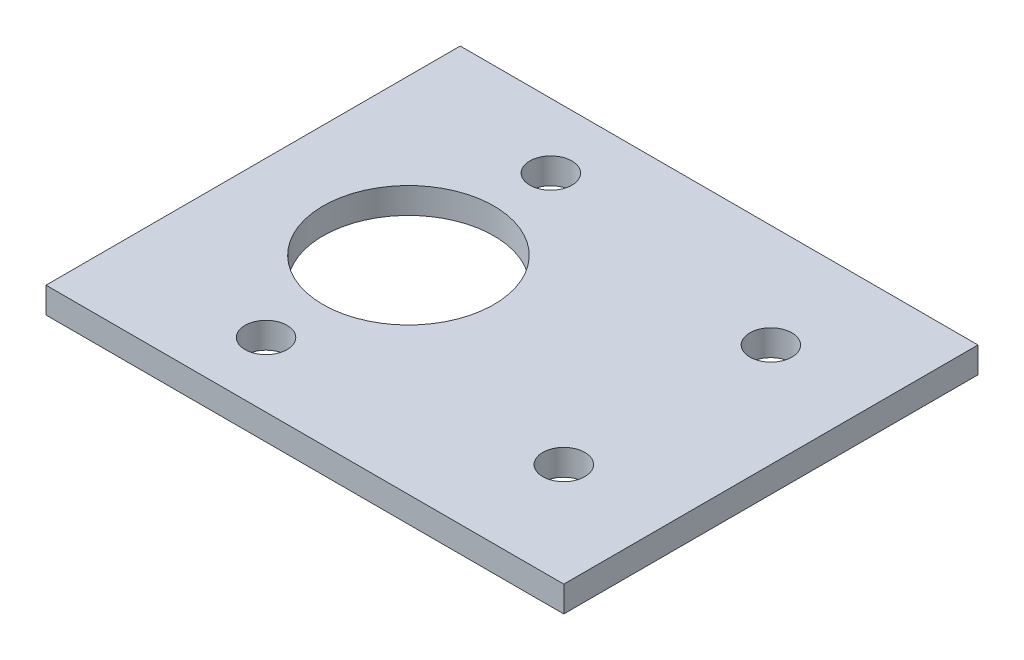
SolidWorks part; units mm, degrees
ref_plane "Front Plane" through (0, 0, 0) normal (0, 0, 1) x (1, 0, 0)
ref_plane "Top Plane" through (0, 0, 0) normal (0, 1, 0) x (1, 0, 0)
ref_plane "Right Plane" through (0, 0, 0) normal (1, 0, 0) x (0, 0, -1)
sketch "Sketch5" plane through (0, 0, 0) normal (0, 1, 0) x (1, 0, 0)
  line L1 (0, 0) -> (-254, 0)
  line L2 (0, 0) -> (0, -203.2)
  line L3 (0, -203.2) -> (-254, -203.2)
  line L4 (-254, 0) -> (-254, -203.2)
  dimension "D1" = 254
  dimension "D2" = 203.2
extrude "Extrude1" add sketch "Sketch5" along normal blind 12.7
sketch "Sketch6" plane through (0, 12.7, 0) normal (0, 1, 0) x (1, 0, 0)
  line L0 (0, -203.2) -> (0, 0) construction
  line L1 (0, 0) -> (-254, 0) construction
  circle A0 centre (-50.8, -50.8) radius 10.3188
  dimension "D1" = 20.6375
  dimension "D2" = 50.8
  dimension "D3" = 50.8
extrude "Cut-Extrude1" cut sketch "Sketch6" against normal blind 12.7
sketch "Sketch7" plane through (0, 12.7, 0) normal (0, 1, 0) x (1, 0, 0)
  line L0 (0, -203.2) -> (0, 0) construction
  line L1 (0, 0) -> (-254, 0) construction
  circle A0 centre (-50.8, -152.4) radius 10.3187
  dimension "D1" = 20.6375
  dimension "D2" = 50.8
  dimension "D3" = 152.4
extrude "Cut-Extrude3" cut sketch "Sketch7" against normal blind 12.7
sketch "Sketch8" plane through (0, 12.7, 0) normal (0, 1, 0) x (1, 0, 0)
  line L0 (0, -203.2) -> (0, 0) construction
  line L1 (0, 0) -> (-254, 0) construction
  circle A0 centre (-177.8, -101.6) radius 41.91
  dimension "D1" = 83.82
  dimension "D2" = 177.8
  dimension "D3" = 101.6
extrude "Cut-Extrude4" cut sketch "Sketch8" against normal blind 12.7
sketch "Sketch13" plane through (0, 12.7, 0) normal (0, 1, 0) x (1, 0, 0)
  line L0 (0, -203.2) -> (0, 0) construction
  line L1 (0, 0) -> (-254, 0) construction
  circle A0 centre (-177.8, -171.45) radius 10.3187
  circle A1 centre (-177.8, -31.75) radius 10.3187
  dimension "D1" = 20.6375
  dimension "D2" = 20.6375
  dimension "D3" = 177.8
  dimension "D4" = 31.75
  dimension "D5" = 171.45
extrude "Cut-Extrude5" cut sketch "Sketch13" against normal blind 12.7
